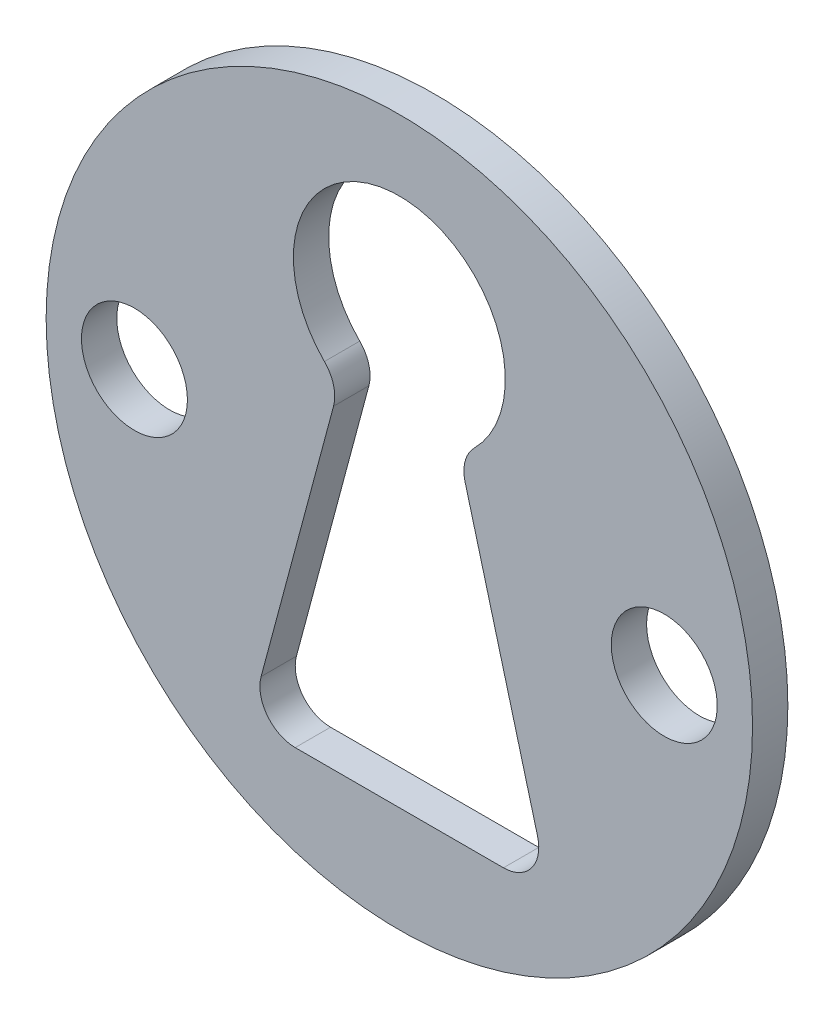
SolidWorks part; units mm, degrees
ref_plane "Plan de face" through (0, 0, 0) normal (0, 0, 1) x (1, 0, 0)
ref_plane "Plan de dessus" through (0, 0, 0) normal (0, 1, 0) x (1, 0, 0)
ref_plane "Plan de droite" through (0, 0, 0) normal (1, 0, 0) x (0, 0, -1)
sketch "Esquisse1" plane through (0, 0, 0) normal (0, 0, 1) x (1, 0, 0)
  line L0 (-10.9019, 0) -> (11.4492, 0) construction
  line L1 (0, 11.372) -> (0, -11.765) construction
  line L2 (-7.5, 3.7508) -> (-7.5, -3.597) construction
  line L3 (7.5, 3.7508) -> (7.5, -3.597) construction
  line L4 (-2.9474, -7) -> (2.9474, -7)
  line L5 (0, 5) -> (-3.8049, 1.1951) construction
  line L6 (-3.9134, -5.7412) -> (-1.8625, 1.9128)
  line L7 (3.9134, -5.7412) -> (1.8625, 1.9128)
  circle A0 centre (0, 0) radius 10
  circle A1 centre (-7.5, 0) radius 1.5
  circle A2 centre (7.5, 0) radius 1.5
  arc A3 (2.1213, 2.8787) -> (-2.1213, 2.8787) centre (0, 5) ccw
  arc A4 (-1.8625, 1.9128) -> (-2.1213, 2.8787) centre (-2.8284, 2.1716) ccw
  arc A5 (-2.9474, -7) -> (-3.9134, -5.7412) centre (-2.9474, -6) cw
  arc A6 (2.9474, -7) -> (3.9134, -5.7412) centre (2.9474, -6) ccw
  arc A7 (1.8625, 1.9128) -> (2.1213, 2.8787) centre (2.8284, 2.1716) cw
  point P26 (0, -7)
  dimension "D1" = 20
  dimension "D2" = 3
  dimension "D4" = 3
  dimension "D6" = 1
  dimension "D3" = 15
  dimension "D5" = 15
  dimension "D7" = 5
  dimension "D8" = 12
  dimension "D9" = 135
extrude "Extrusion1" add sketch "Esquisse1" along normal blind 1
other "Enregistrer les corps4"
